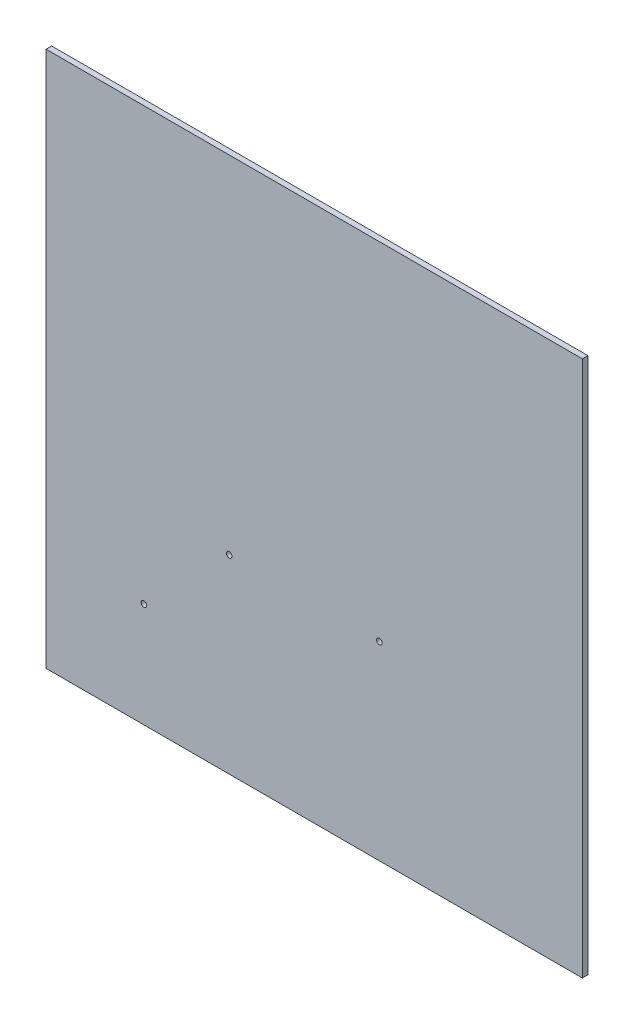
SolidWorks part; units mm, degrees
ref_plane "Front Plane" through (0, 0, 0) normal (0, 0, 1) x (1, 0, 0)
ref_plane "Top Plane" through (0, 0, 0) normal (0, 1, 0) x (1, 0, 0)
ref_plane "Right Plane" through (0, 0, 0) normal (1, 0, 0) x (0, 0, -1)
sketch "Sketch1" plane through (0, 0, 0) normal (0, 0, 1) x (1, 0, 0)
  line L0 (55.5839, 59.4802) -> (104.0773, 107.9735) construction
  line L1 (0, 0) -> (304.8, 0)
  line L2 (0, 0) -> (0, 304.8)
  line L3 (0, 304.8) -> (304.8, 304.8)
  line L4 (304.8, 0) -> (304.8, 304.8)
  line L5 (104.0773, 107.9735) -> (189.4213, 107.9735) construction
  circle A0 centre (104.0773, 107.9735) radius 1.5875
  circle A1 centre (189.4213, 107.9735) radius 1.5875
  circle A2 centre (55.5839, 59.4802) radius 1.5875
  dimension "D3" = 3.175
  dimension "D4" = 85.344
  dimension "D1" = 304.8
  dimension "D2" = 304.8
  dimension "D5" = 135
  dimension "D6" = 68.58
extrude "Boss-Extrude1" add sketch "Sketch1" along normal blind 3.175
